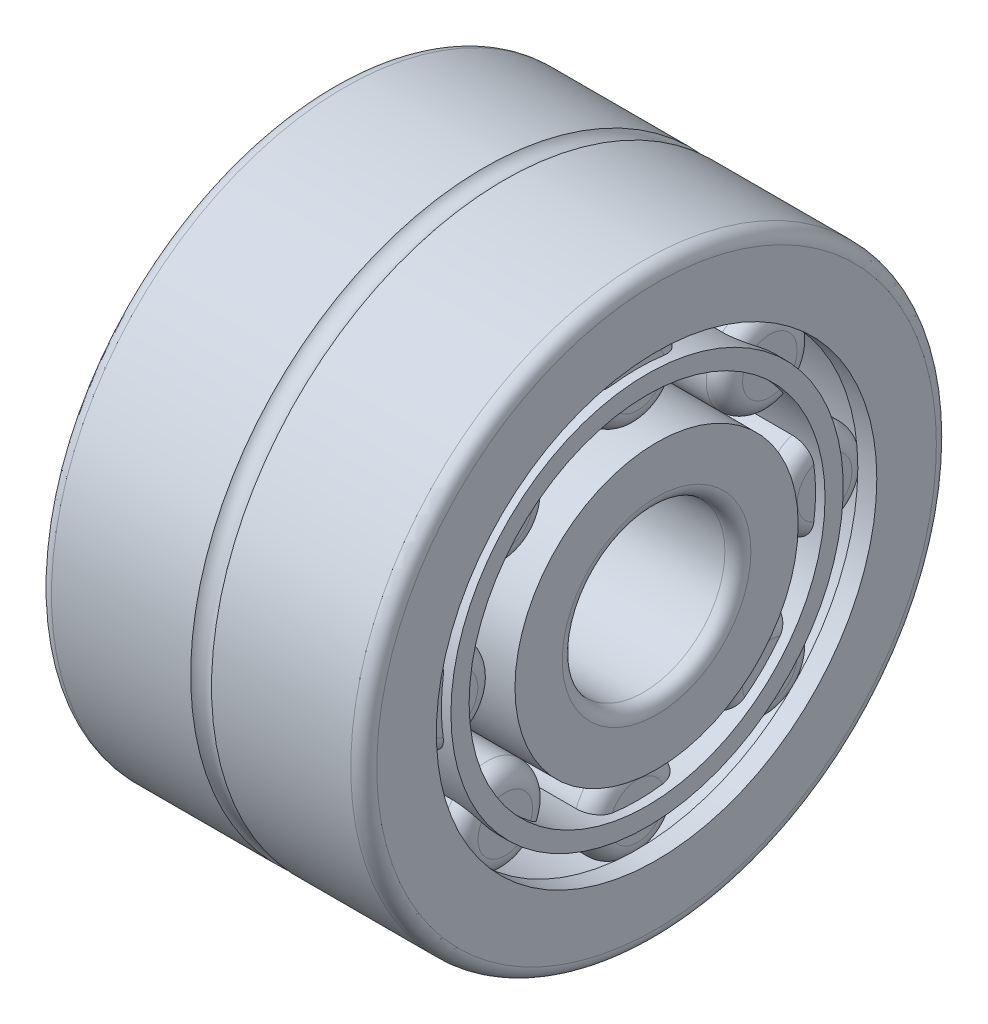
SolidWorks part; units mm, degrees
ref_plane "Plane1" through (0, 0, 0) normal (0, 0, 1) x (1, 0, 0)
ref_plane "Plane2" through (0, 0, 0) normal (0, 1, 0) x (1, 0, 0)
ref_plane "Plane3" through (0, 0, 0) normal (1, 0, 0) x (0, 0, -1)
other "Configuration Table"
sketch "Clipboard" plane through (0, 0, 0) normal (0, 0, 1) x (1, 0, 0)
  line L0 (-10, 0) -> (10, 0) construction
  line L1 (0, 0) -> (27.3694, -3.8465)
  line L2 (0, 0) -> (36.1572, 5.0816)
  line L3 (0, 0) -> (44.9449, -6.3166)
  line L4 (0, 0) -> (-22.3471, -0.7804)
sketch "OutRacSke" plane through (0, 0, 0) normal (0, 0, 1) x (1, 0, 0)
  line L0 (-14.0229, 22.6933) -> (-14.0229, 21.4933)
  line L1 (-14.0229, 21.4933) -> (-15.875, 21.4933)
  line L2 (-15.875, 21.4933) -> (-15.875, 27.305)
  line L3 (-14.605, 28.575) -> (-1.016, 28.575)
  line L4 (15.875, 27.305) -> (15.875, 21.4933)
  line L5 (15.875, 21.4933) -> (14.0229, 21.4933)
  line L6 (14.0229, 21.4933) -> (14.0229, 22.6933)
  line L7 (14.0229, 22.6933) -> (-14.0229, 22.6933)
  line L8 (-7.9375, 0) -> (7.9375, 0) construction
  line L9 (1.016, 28.575) -> (14.605, 28.575)
  arc A0 (-15.875, 27.305) -> (-14.605, 28.575) centre (-14.605, 27.305) cw
  arc A1 (14.605, 28.575) -> (15.875, 27.305) centre (14.605, 27.305) cw
  arc A2 (-1.016, 28.575) -> (1.016, 28.575) centre (0, 29.337) ccw
revolve "OuterRace" add sketch "OutRacSke" angle 360 about L8
sketch "RolDetSke" plane through (0, 0, 0) normal (0, 0, 1) x (1, 0, 0)
  line L0 (-14.0229, 20.9188) -> (-14.0229, 18.2562)
  line L1 (-14.0229, 18.2562) -> (14.0229, 18.2562)
  line L2 (14.0229, 18.2562) -> (14.0229, 20.9188)
  line L3 (12.2479, 22.6938) -> (-12.2479, 22.6938)
  line L4 (-28.575, 18.2562) -> (28.575, 18.2562) construction
  arc A0 (14.0229, 20.9188) -> (12.2479, 22.6938) centre (12.2479, 20.9188) ccw
  arc A1 (-12.2479, 22.6938) -> (-14.0229, 20.9188) centre (-12.2479, 20.9188) ccw
revolve "RollerDetailed" add sketch "RolDetSke" angle 360 about L4
ref_axis "Axis1" through (-50, 0, 0) along (1, 0, 0)
sketch "RolSimSke" plane through (0, 25.4, 0) normal (0, 0, 1) x (1, 0, 0)
  line L0 (-14.0229, -4.4807) -> (-14.0229, -9.8058)
  line L1 (-25.4, -25.4) -> (25.4, -25.4) construction
  line L2 (14.0229, -9.8058) -> (14.0229, -4.4807)
  line L3 (12.2479, -2.7057) -> (-12.2479, -2.7057)
  line L5 (12.2479, -11.5808) -> (-12.2479, -11.5808)
  arc A0 (14.0229, -4.4807) -> (12.2479, -2.7057) centre (12.2479, -4.4807) ccw
  arc A1 (-12.2479, -2.7057) -> (-14.0229, -4.4807) centre (-12.2479, -4.4807) ccw
  arc A2 (14.0229, -9.8058) -> (12.2479, -11.5808) centre (12.2479, -9.8058) cw
  arc A3 (-12.2479, -11.5808) -> (-14.0229, -9.8058) centre (-12.2479, -9.8058) cw
revolve "RollersSimplified" [suppressed] add sketch "RolSimSke" angle 360 about L1
sketch "InsRacSke" plane through (0, 0, 0) normal (0, 0, 1) x (1, 0, 0)
  line L2 (-15.875, 13.8192) -> (-15.875, 9.2075)
  line L4 (-14.605, 7.9375) -> (14.605, 7.9375)
  line L5 (15.875, 9.2075) -> (15.875, 13.8192)
  line L8 (15.875, 13.8192) -> (-15.875, 13.8192)
  line L9 (-7.9375, 0) -> (7.9375, 0) construction
  arc A0 (-15.875, 9.2075) -> (-14.605, 7.9375) centre (-14.605, 9.2075) ccw
  arc A2 (14.605, 7.9375) -> (15.875, 9.2075) centre (14.605, 9.2075) ccw
revolve "InnerRace" add sketch "InsRacSke" angle 360 about L9
sketch "CagSpiSke" plane through (0, 0, 0) normal (0, 0, 1) x (1, 0, 0)
  line L0 (-17.1595, 0) -> (17.1595, 0) construction
  line L3 (-14.949, 17.3687) -> (14.949, 17.3687)
  line L4 (-14.949, 17.3687) -> (-14.949, 19.1438)
  line L5 (-14.949, 19.1438) -> (14.949, 19.1438)
  line L6 (14.949, 17.3687) -> (14.949, 19.1438)
revolve "CageSpine" add sketch "CagSpiSke" angle 360 about L0
pattern_circular "RollersDetailed" count 8 every 45 about axis through (-50, 0, 0) along (1, 0, 0) of "RollerDetailed"
equation "\"halfWidth@OutRacSke\" =  \"Width@OutRacSke\" / 2"
equation "\"CLdia@Clipboard\" =  ( \"Race_OD@Clipboard\" + \"Race_ID@Clipboard\" )  / 2"
equation "\"CLRad@RolDetSke\" = ( \"Race_OD@Clipboard\" + \"Race_ID@Clipboard\" )  / 4"
equation "\"Roller_diameter@RolDetSke\" =  ( \"Race_OD@Clipboard\" -  \"Race_ID@Clipboard\" )  / 2 + .001"
equation "\"Roller_diameter@RolSimSke\" = ( \"Race_OD@Clipboard\" -  \"Race_ID@Clipboard\" )  / 2 + .001"
equation "\"radius@RolDetSke\" = \"Roller_diameter@RolDetSke\" / 5"
equation "\"radius@RolSimSke\" = \"Roller_diameter@RolSimSke\" / 5"
equation "\"Cyl_Len@OutRacSke\" = \"Cyl_Len@RolDetSke\""
equation "\"Cyl_Len@RolSimSke\" = \"Cyl_Len@RolDetSke\""
equation "\"halfCylLen@RolDetSke\" = \"Cyl_Len@RolDetSke\" / 2"
equation "\"D1@OutRacSke\" = \"Cyl_Len@OutRacSke\" / 2"
equation "\"D2@OutRacSke\" = \"Radius@OutRacSke\" * .6"
equation "\"cage_width@CagSpiSke\" =  ( \"Cyl_Len@RolDetSke\" + \"Width@OutRacSke\" )  / 2"
equation "\"halfwidth@CagSpiSke\" = \"cage_width@CagSpiSke\" / 2"
equation "\"cage_thickness@CagSpiSke\" = \"Roller_diameter@RolDetSke\" / 5"
equation "\"d2@CagSpiSke\" = \"CLRad@RolDetSke\" * 2 - \"cage_thickness@CagSpiSke\""
equation "\"Max_count@Clipboard\" = int( 3.14159265 / atn(( \"Roller_diameter@RolDetSke\" / 2) / sqr( \"CLRad@RolDetSke\"  *  \"CLRad@RolDetSke\" - ( \"Roller_diameter@RolDetSke\" / 2) *  ( \"Roller_diameter@RolDetSke\" / "
equation "\"Max_count@Clipboard\" = ((sgn( \"Max_count@Clipboard\" - \"Count@Clipboard\" )-1)*( \"Max_count@Clipboard\" - \"Count@Clipboard\" ))/-2+ \"Count@Clipboard\""
equation "\"Count@RollersDetailed\" = int( \"Show_count@Clipboard\" ) "
equation "\"Count@RollersDetailed\" = ((sgn( \"Count@RollersDetailed\" - \"Max_count@Clipboard\" )-1)*( \"Count@RollersDetailed\" - \"Max_count@Clipboard\" ))/-2+ \"Max_count@Clipboard\""
equation "\"Count@RollersDetailed\" = ((sgn( \"Count@RollersDetailed\" - \"Min_count@Clipboard\" )+1)*( \"Count@RollersDetailed\" - \"Min_count@Clipboard\"))/2 +\"Min_count@Clipboard\""
equation "\"Angle@RollersDetailed\" = 360.0 / \"Max_count@Clipboard\""
equation "\"Bore@RolSimSke\" = \"Race_ID@Clipboard\""
equation "\"Race_ID@InsRacSke\" = \"Race_ID@Clipboard\""
equation "\"halfWidth@InsRacSke\" = \"Width_IR@InsRacSke\" / 2"
equation "\"halfLength@RolSimSke\" = \"Cyl_Len@RolSimSke\" / 2"
equation "\"Race_OD@OutRacSke\" = \"Race_OD@Clipboard\""
equation "\"Width_IR@InsRacSke\" = \"Width@OutRacSke\""
equation "\"Angle@CageSpine\" =  \"Angle@RollersDetailed\" * ( \"Count@RollersDetailed\" -1 + int( \"Count@RollersDetailed\" / \"Max_count@Clipboard\" ) )  + 0.001 -  int( \"Count@RollersDetailed\" / \"Max_count@Clipboard\" "
equation "\"Angle@CageSpine\" =  \"Angle@CageSpine\" * int( \"Min_count@Clipboard\" / 2) + int(1 / \"Min_count@Clipboard\")  * 0.001"
equation "\"radius@InsRacSke\" = \"Radius@OutRacSke\""
